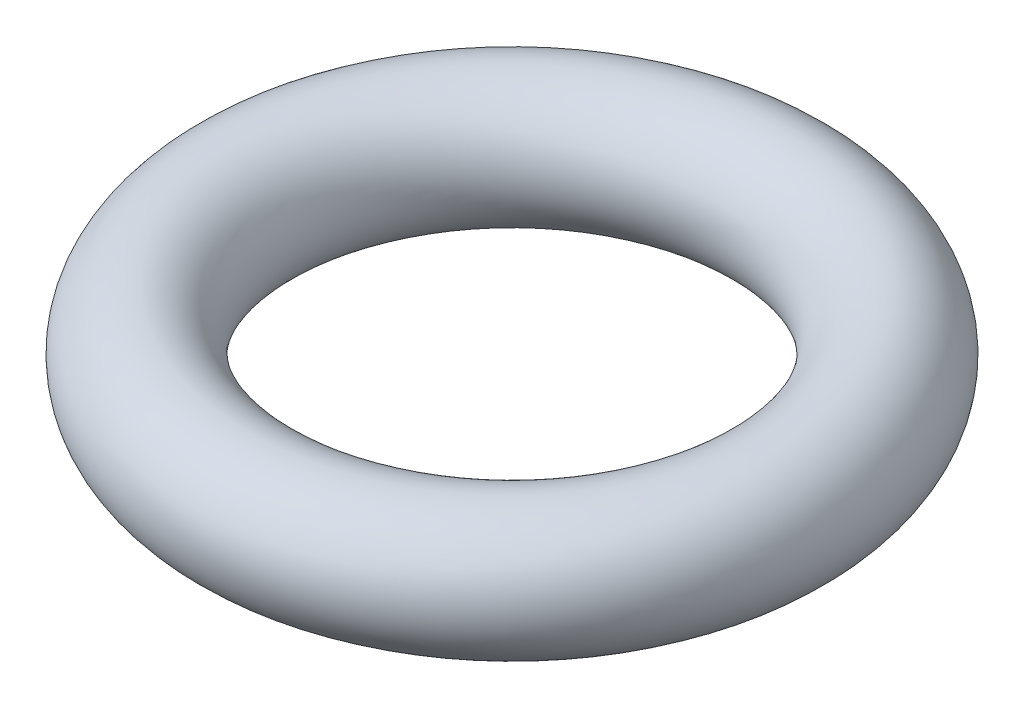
SolidWorks part; units mm, degrees
ref_plane "Plan de face" through (0, 0, 0) normal (0, 0, 1) x (1, 0, 0)
ref_plane "Plan de dessus" through (0, 0, 0) normal (0, 1, 0) x (1, 0, 0)
ref_plane "Plan de droite" through (0, 0, 0) normal (1, 0, 0) x (0, 0, -1)
sketch "Esquisse1" plane through (0, 0, 0) normal (0, 0, 1) x (1, 0, 0)
  line L0 (0, 0) -> (0, 24.5765) construction
  line L1 (0, 0) -> (3.525, 0) construction
  circle A0 centre (3.525, 0) radius 0.85
  point P5 (4.375, 0)
  dimension "D1" = 1.7
  dimension "D2" = 8.75
revolve "Révolution1" add sketch "Esquisse1" angle 360 about L0
